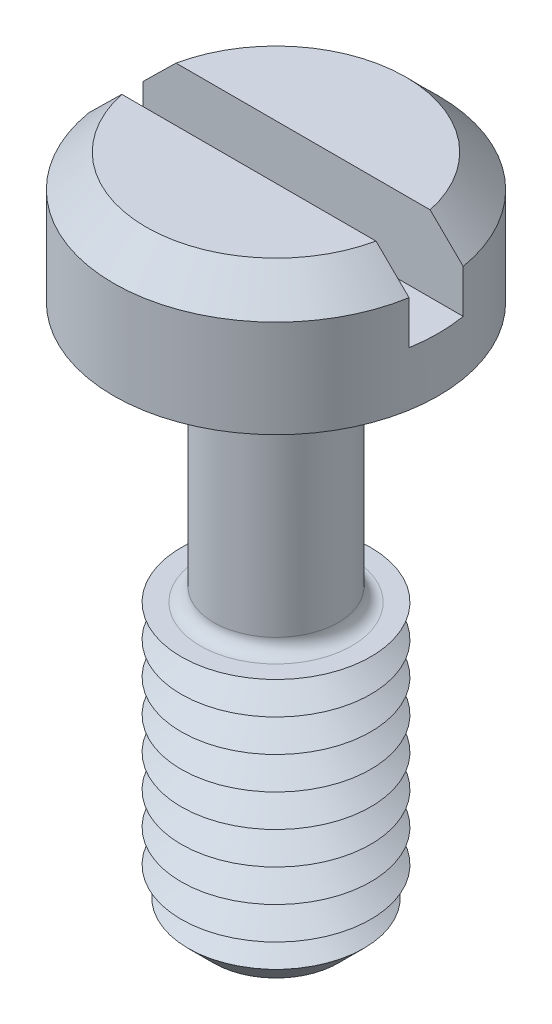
SolidWorks part; units mm, degrees
ref_plane "Front Plane" through (0, 0, 0) normal (0, 0, 1) x (1, 0, 0)
ref_plane "Top Plane" through (0, 0, 0) normal (0, 1, 0) x (1, 0, 0)
ref_plane "Right Plane" through (0, 0, 0) normal (1, 0, 0) x (0, 0, -1)
sketch "Sketch1" plane through (0, 0, 0) normal (0, 1, 0) x (1, 0, 0)
  circle A0 centre (0, 0) radius 3
  dimension "D1" = 6
extrude "Boss-Extrude1" add sketch "Sketch1" along normal blind 2.4
sketch "Sketch2" plane through (0, 0, 0) normal (0, -1, 0) x (1, 0, 0)
  circle A0 centre (0, 0) radius 1.15
  dimension "D1" = 2.3
extrude "Boss-Extrude2" add sketch "Sketch2" along normal blind 10
sketch "Sketch3" plane through (0, -10, 0) normal (0, -1, 0) x (1, 0, 0)
  circle A0 centre (0, 0) radius 1.75
  dimension "D1" = 3.5
extrude "Boss-Extrude3" add sketch "Sketch3" against normal blind 5.2
chamfer "Chamfer1" distance 0.6 angle 45 1 edges at (0, -10, -1.75)
sketch "Sketch4" plane through (0, 0, 0) normal (1, 0, 0) x (0, 0, -1)
  line L0 (0, -6.5871) -> (0, -12.0372) construction
sketch "Sketch5" plane through (0, 0, 0) normal (1, 0, 0) x (0, 0, -1)
  line L0 (-1.75, -4.8) -> (-1.2304, -5.1)
  line L1 (-1.2304, -5.1) -> (-1.75, -5.4)
  line L2 (-1.75, -4.8) -> (-1.75, -9.4) construction
  line L3 (-1.75, -5.4) -> (-1.75, -4.8)
  dimension "D1" = 0.6
revolve "Cut-Revolve1" cut sketch "Sketch5" angle 360 about L0
pattern_linear "LPattern1" count 8 spacing 0.6 along (0, -1, 0) of "Cut-Revolve1"
fillet "Fillet1" radius 0.25 2 edges at (0, -4.8, -1.15) (0, 0, -1.15)
chamfer "Chamfer2" distance 0.6 angle 45 1 edges at (0, 2.4, 3)
sketch "Sketch6" plane through (0, 2.4, 0) normal (0, 1, 0) x (1, 0, 0)
  line L1 (3, -0.5) -> (-3, -0.5)
  line L2 (3, -0.5) -> (3, 0.5)
  line L3 (3, 0.5) -> (-3, 0.5)
  line L4 (-3, -0.5) -> (-3, 0.5)
  line L5 (3, -0.5) -> (-3, 0.5) construction
  line L6 (3, 0.5) -> (-3, -0.5) construction
  circle A0 centre (0, 0) radius 3 construction
  point P0 (0, 0)
  dimension "D1" = 1
extrude "Cut-Extrude1" cut sketch "Sketch6" against normal blind 1.4
